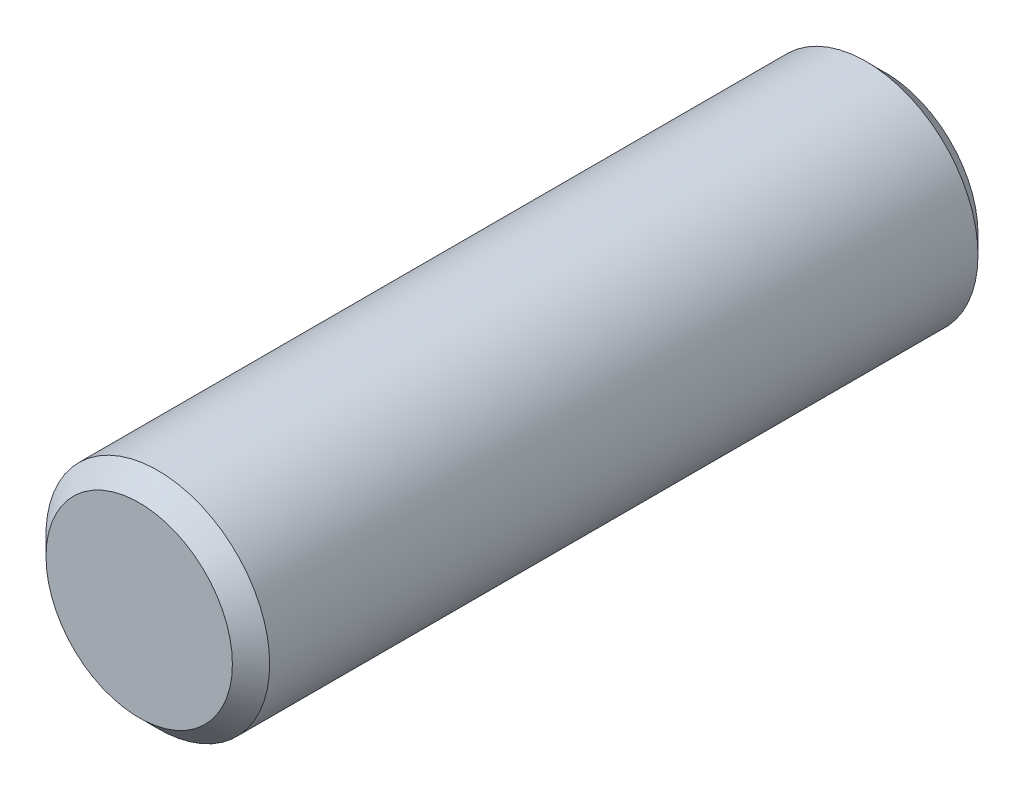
SolidWorks part; units mm, degrees
ref_plane "Face" through (0, 0, 0) normal (0, 0, 1) x (1, 0, 0)
ref_plane "Dessus" through (0, 0, 0) normal (0, 1, 0) x (1, 0, 0)
ref_plane "Droite" through (0, 0, 0) normal (1, 0, 0) x (0, 0, -1)
sketch "Esquisse1" plane through (0, 0, 0) normal (0, 0, 1) x (1, 0, 0)
  circle A0 centre (0, 0) radius 0.6
  dimension "D1" = 1.2
extrude "Extrusion1" add sketch "Esquisse1" along normal blind 4
chamfer "Chanfrein1" distance 0.1 angle 45 2 edges at (0.6, 0, 0) (0.6, 0, 4)
